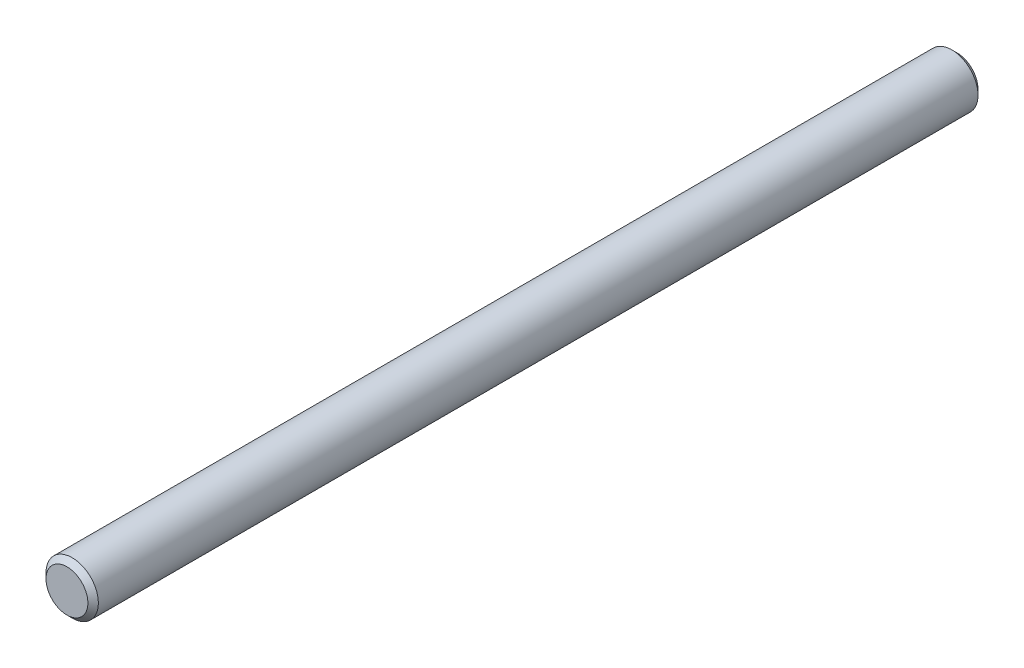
SolidWorks part; units mm, degrees
ref_plane "Plan1" through (0, 0, 0) normal (0, 0, 1) x (1, 0, 0)
ref_plane "Plan2" through (0, 0, 0) normal (0, 1, 0) x (1, 0, 0)
ref_plane "Plan3" through (0, 0, 0) normal (1, 0, 0) x (0, 0, -1)
sketch "Esquisse1" plane through (0, 0, 0) normal (0, 0, 1) x (1, 0, 0)
  circle A0 centre (0, 0) radius 5
  dimension "D1" = 10
extrude "Base-Extrusion" add sketch "Esquisse1" along normal blind 170
chamfer "Chanfrein1" distance 1 angle 45
